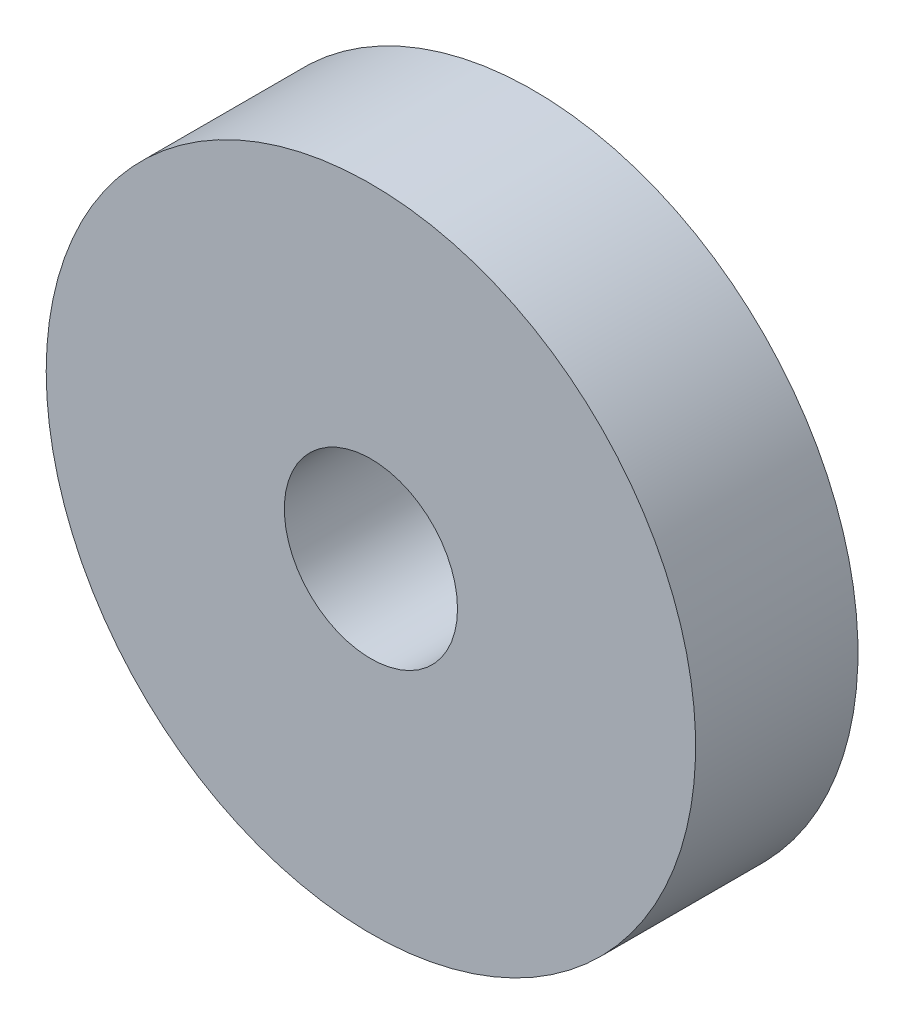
SolidWorks part; units mm, degrees
ref_plane "Front" through (0, 0, 0) normal (0, 0, 1) x (1, 0, 0)
ref_plane "Top" through (0, 0, 0) normal (0, 1, 0) x (1, 0, 0)
ref_plane "Right" through (0, 0, 0) normal (1, 0, 0) x (0, 0, -1)
sketch "Sketch1" plane through (0, 0, 0) normal (0, 0, 1) x (1, 0, 0)
  circle A0 centre (0, 0) radius 9.525
  dimension "D1" = 19.05
extrude "Boss-Extrude1" add sketch "Sketch1" along normal blind 4.7625
sketch "Sketch2" plane through (0, 0, 4.7625) normal (0, 0, 1) x (1, 0, 0)
  circle A0 centre (0, 0) radius 2.54
  dimension "D1" = 5.08
extrude "Cut-Extrude1" cut sketch "Sketch2" against normal through all
